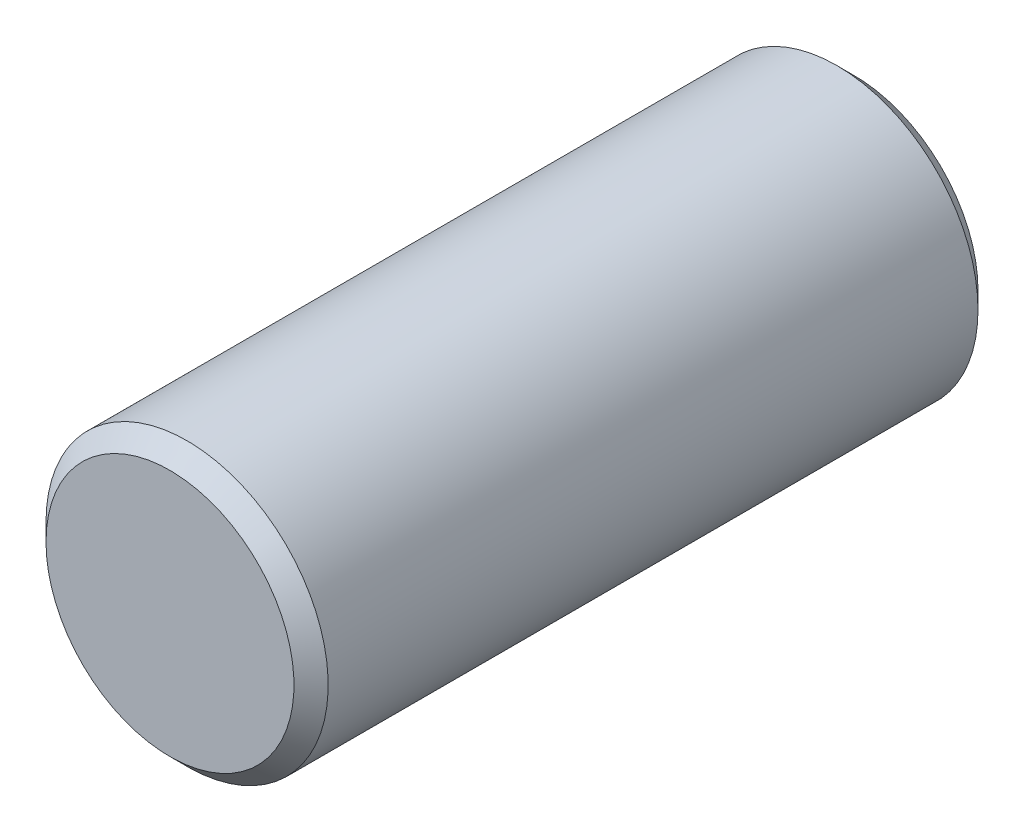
SolidWorks part; units mm, degrees
ref_plane "Face" through (0, 0, 0) normal (0, 0, 1) x (1, 0, 0)
ref_plane "Dessus" through (0, 0, 0) normal (0, 1, 0) x (1, 0, 0)
ref_plane "Droite" through (0, 0, 0) normal (1, 0, 0) x (0, 0, -1)
sketch "Esquisse1" plane through (0, 0, 0) normal (0, 0, 1) x (1, 0, 0)
  circle A0 centre (0, 0) radius 0.825
  dimension "D1" = 1.65
extrude "Extrusion1" add sketch "Esquisse1" along normal blind 4
chamfer "Chanfrein1" distance 0.1 angle 45 2 edges at (0.825, 0, 0) (0.825, 0, 4)
